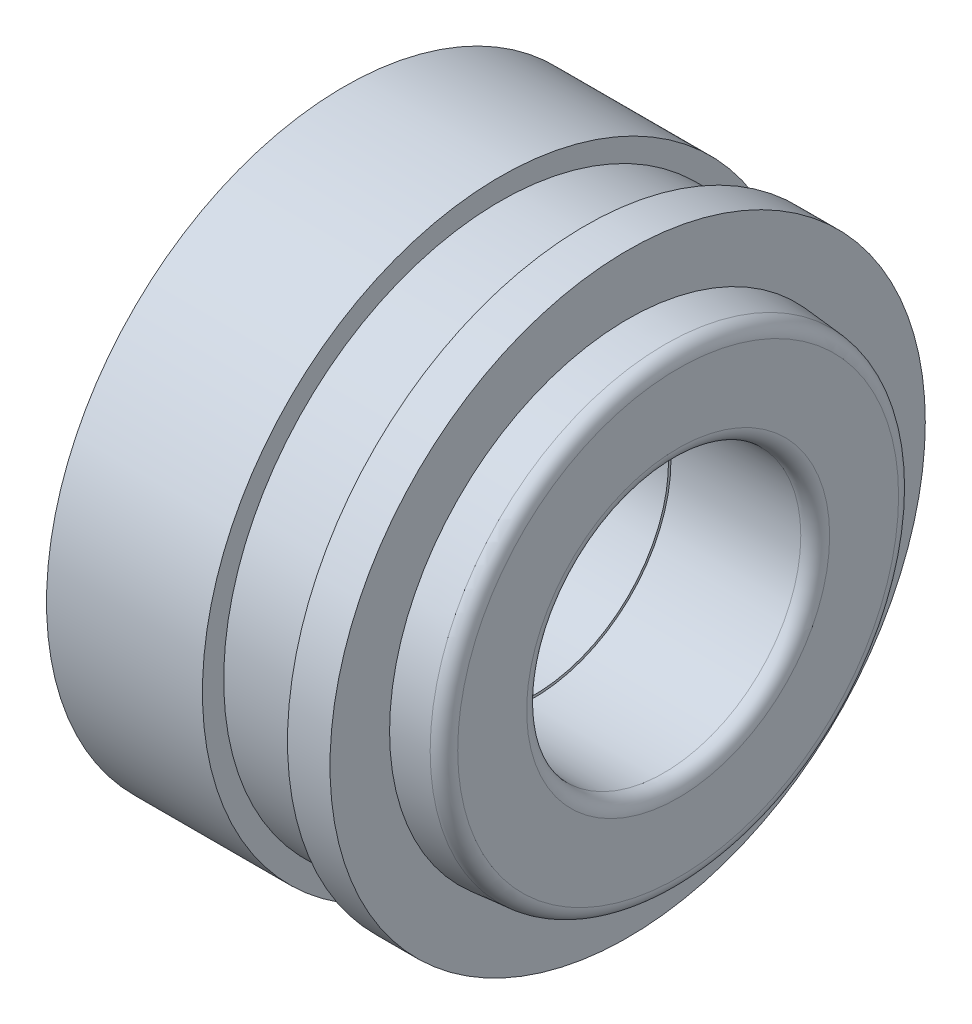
SolidWorks part; units mm, degrees
ref_plane "Face" through (0, 0, 0) normal (0, 0, 1) x (1, 0, 0)
ref_plane "Dessus" through (0, 0, 0) normal (0, 1, 0) x (1, 0, 0)
ref_plane "Droite" through (0, 0, 0) normal (1, 0, 0) x (0, 0, -1)
sketch "Esquisse1" plane through (0, 0, 0) normal (0, 0, 1) x (1, 0, 0)
  line L0 (35.4426, 0) -> (-38.695, 0) construction
  line L1 (11.5, 0) -> (11.5, 17)
  line L2 (6.5, 21) -> (3.5, 21)
  line L3 (3.5, 21) -> (3.5, 19.5)
  line L4 (3.5, 19.5) -> (-2.5, 19.5)
  line L5 (-2.5, 19.5) -> (-2.5, 21)
  line L6 (-2.5, 21) -> (-13.5, 21)
  line L7 (-13.5, 21) -> (-13.5, 0)
  line L8 (11.5, 0) -> (-13.5, 0)
  line L9 (6.5, 21) -> (6.5, 17)
  line L10 (6.5, 17) -> (11.5, 17)
  dimension "D1" = 42
  dimension "D2" = 3
  dimension "D3" = 11
  dimension "D4" = 25
  dimension "D5" = 6
  dimension "D6" = 1.5
  dimension "D7" = 11.5
  dimension "D8" = 34
revolve "Base-Révolution" add sketch "Esquisse1" angle 360 about L0
sketch "Esquisse2" plane through (11.5, 0, 0) normal (1, 0, 0) x (0, 0, -1)
  circle A0 centre (0, 0) radius 9.5
  dimension "D1" = 19
extrude "Enlèv. mat.-Extru.1" cut sketch "Esquisse2" against normal through all
sketch "Esquisse3" plane through (-13.5, 0, 0) normal (-1, 0, 0) x (0, 0, 1)
  circle A0 centre (0, 0) radius 10.25
  dimension "D1" = 20.5
extrude "Enlèv. mat.-Extru.2" cut sketch "Esquisse3" against normal blind 6
other "Empreinte1"
other "Porte_clef_G_r1-8<1>@creation empreintes1"
